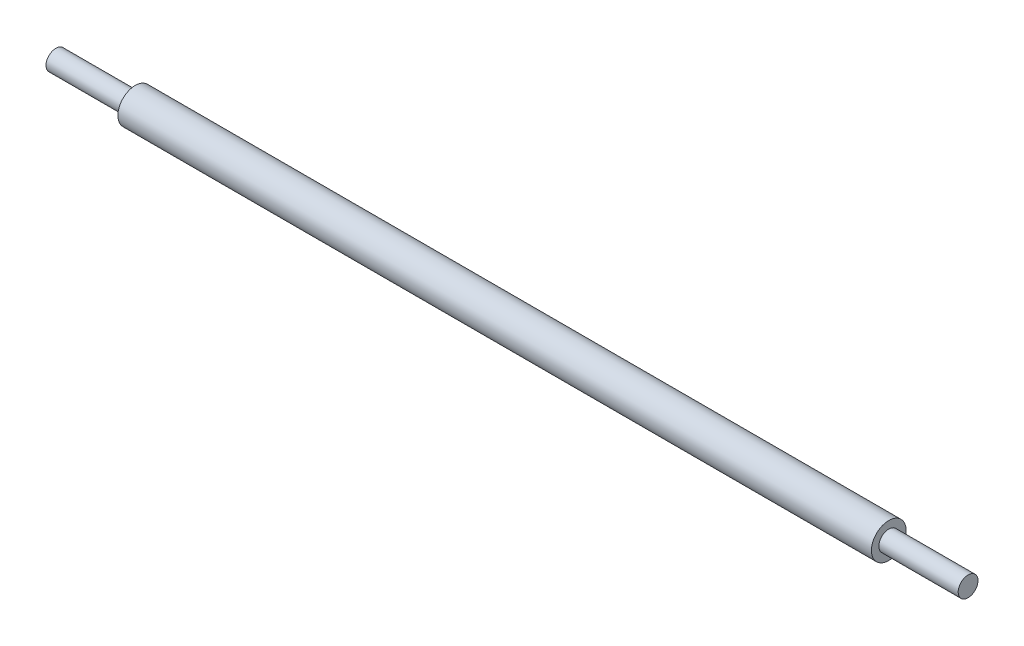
SolidWorks part; units mm, degrees
ref_plane "Plan de face" through (0, 0, 0) normal (0, 0, 1) x (1, 0, 0)
ref_plane "Plan de dessus" through (0, 0, 0) normal (0, 1, 0) x (1, 0, 0)
ref_plane "Plan de droite" through (0, 0, 0) normal (1, 0, 0) x (0, 0, -1)
sketch "Esquisse1" plane through (0, 0, 0) normal (0, 0, 1) x (1, 0, 0)
  line L0 (-460, 0) -> (-460, 10)
  line L1 (-460, 10) -> (-380, 10)
  line L2 (-380, 10) -> (-380, 17.5)
  line L3 (-380, 17.5) -> (380, 17.5)
  line L4 (380, 17.5) -> (380, 10)
  line L5 (380, 10) -> (460, 10)
  line L6 (460, 10) -> (460, 0)
  line L7 (460, 0) -> (-460, 0)
  line L8 (-460, 0) -> (-489.2095, 0) construction
  dimension "D1" = 920
  dimension "D2" = 760
  dimension "D3" = 80
  dimension "D4" = 20
  dimension "D5" = 35
revolve "Révolution1" add sketch "Esquisse1" angle 360 about L8
